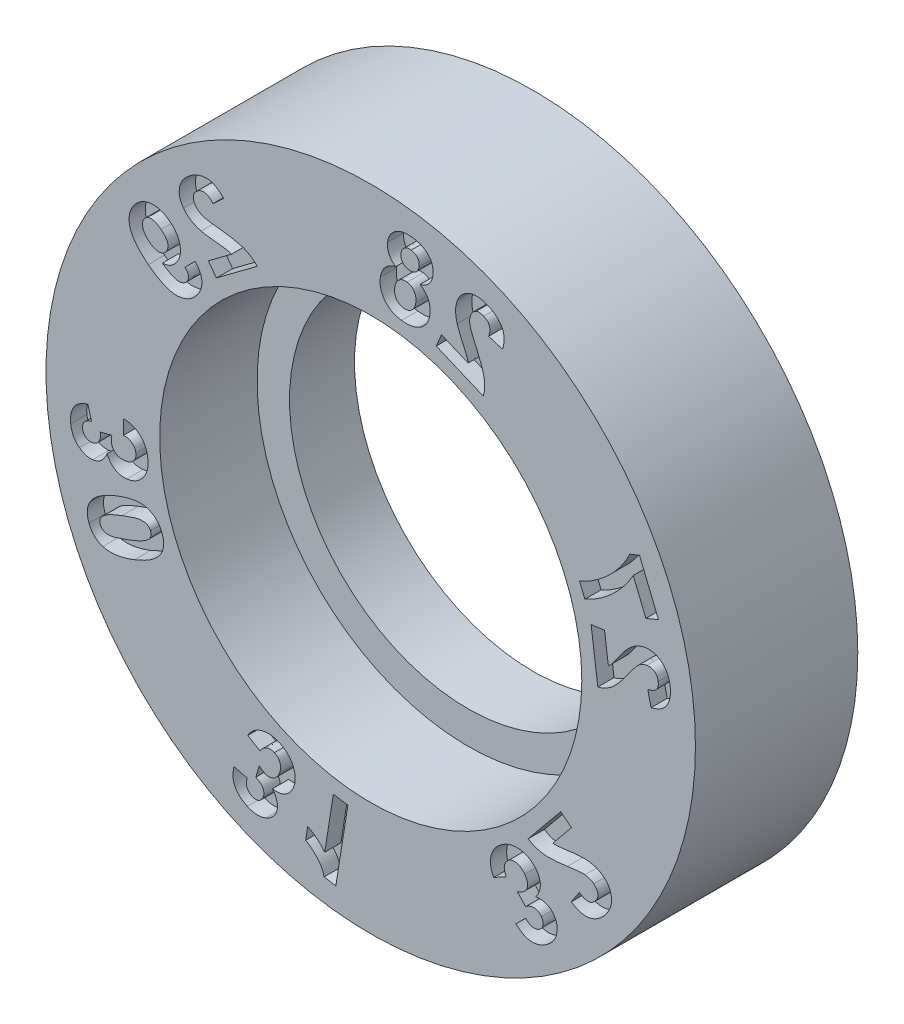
SolidWorks part; units mm, degrees
ref_plane "Front Plane" through (0, 0, 0) normal (0, 0, 1) x (1, 0, 0)
ref_plane "Top Plane" through (0, 0, 0) normal (0, 1, 0) x (1, 0, 0)
ref_plane "Right Plane" through (0, 0, 0) normal (1, 0, 0) x (0, 0, -1)
imported_body "Imported1"
other "DeleteFace1"
sketch "Sketch1" plane through (0, 0, 0) normal (0, 0, 1) x (1, 0, 0)
  line L0 (0, 0) -> (0, 11.8635) construction
  line L1 (0, 0) -> (10.2741, 5.9318) construction
  line L2 (0, 0) -> (10.2741, -5.9318) construction
  line L3 (0, 0) -> (0, -11.8635) construction
  line L4 (0, 0) -> (-10.2741, -5.9318) construction
  line L5 (0, 0) -> (-10.2741, 5.9318) construction
  circle A0 centre (0, 0) radius 7.0035 construction
  text T0 "27    28    29    30    31    32" font "Arial" height 2.37
  point P12 (0, 0)
  dimension "D1" = 6
extrude "Cut-Extrude1" cut sketch "Sketch1" against normal blind 0.5
